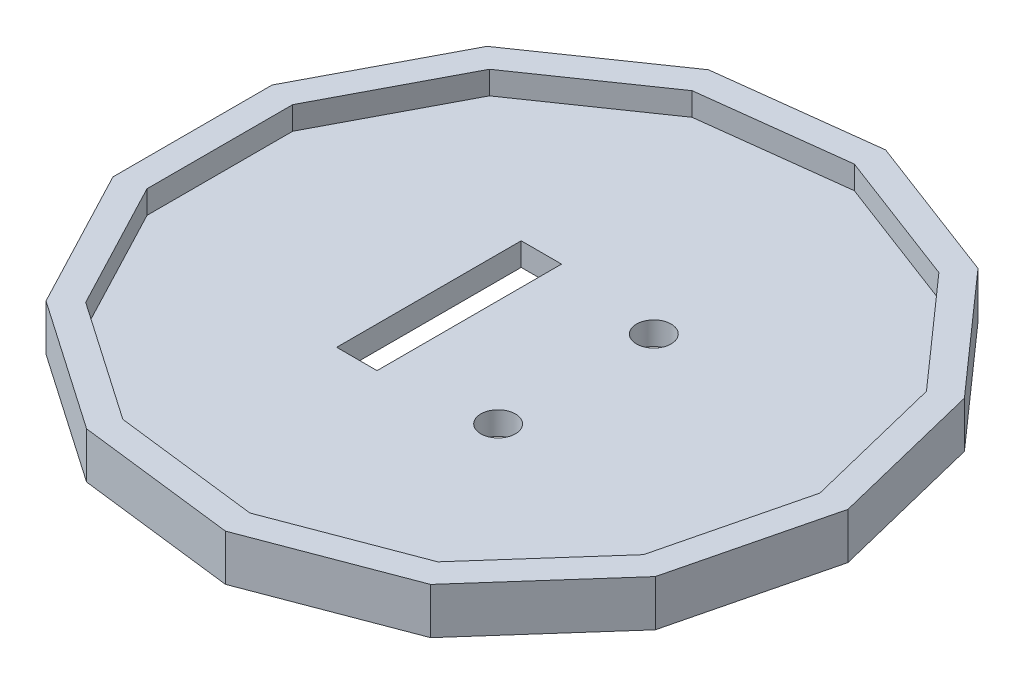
SolidWorks part; units mm, degrees
ref_plane "Front Plane" through (0, 0, 0) normal (0, 0, 1) x (1, 0, 0)
ref_plane "Top Plane" through (0, 0, 0) normal (0, 1, 0) x (1, 0, 0)
ref_plane "Right Plane" through (0, 0, 0) normal (1, 0, 0) x (0, 0, -1)
sketch "Sketch5" plane through (0, 0, 0) normal (0, 1, 0) x (1, 0, 0)
  line L36 (-21.5855, 19.1231) -> (-28, 6.9014)
  line L37 (27.8081, 0) -> (24.6228, 12.923) construction
  line L46 (24.6228, 12.923) -> (15.7968, 22.8856) construction
  line L50 (15.7968, 22.8856) -> (3.3519, 27.6053) construction
  line L51 (3.3519, 27.6053) -> (-9.8609, 26.001) construction
  line L52 (-9.8609, 26.001) -> (-20.8146, 18.4401) construction
  line L58 (-20.8146, 18.4401) -> (-27, 6.6549) construction
  line L59 (-26, -6.4084) -> (-20.0437, -17.7572) construction
  line L60 (-20.0437, -17.7572) -> (-9.4957, -25.038) construction
  line L61 (-9.4957, -25.038) -> (3.2277, -26.5829) construction
  line L62 (3.2277, -26.5829) -> (15.2117, -22.038) construction
  line L63 (-27, 6.6549) -> (-27, -6.6549) construction
  line L64 (-27, -6.6549) -> (-20.8146, -18.4401) construction
  line L65 (-20.8146, -18.4401) -> (-9.8609, -26.001) construction
  line L66 (-9.8609, -26.001) -> (3.3519, -27.6053) construction
  line L67 (3.3519, -27.6053) -> (15.7968, -22.8856) construction
  line L68 (15.7968, -22.8856) -> (24.6228, -12.923) construction
  line L69 (24.6228, -12.923) -> (27.8081, 0) construction
  line L70 (-28, 6.9014) -> (-28, -6.9014)
  line L71 (-28, -6.9014) -> (-21.5855, -19.1231)
  line L72 (-21.5855, -19.1231) -> (-10.2261, -26.964)
  line L73 (-10.2261, -26.964) -> (3.476, -28.6277)
  line L74 (3.476, -28.6277) -> (16.3818, -23.7332)
  line L75 (16.3818, -23.7332) -> (25.5348, -13.4017)
  line L76 (25.5348, -13.4017) -> (28.838, 0)
  line L77 (28.838, 0) -> (25.5348, 13.4017)
  line L78 (25.5348, 13.4017) -> (16.3818, 23.7332)
  line L79 (16.3818, 23.7332) -> (3.476, 28.6277)
  line L80 (3.476, 28.6277) -> (-10.2261, 26.964)
  line L81 (-10.2261, 26.964) -> (-21.5855, 19.1231)
  line L82 (15.2117, -22.038) -> (23.7109, -12.4444) construction
  line L83 (23.7109, -12.4444) -> (26.7781, 0) construction
  line L84 (26.7781, 0) -> (23.7109, 12.4444) construction
  line L85 (23.7109, 12.4444) -> (15.2117, 22.038) construction
  line L86 (15.2117, 22.038) -> (3.2277, 26.5829) construction
  line L87 (3.2277, 26.5829) -> (-9.4957, 25.038) construction
  line L88 (-9.4957, 25.038) -> (-20.0437, 17.7572) construction
  line L89 (-20.0437, 17.7572) -> (-26, 6.4084) construction
  line L90 (-26, 6.4084) -> (-26, -6.4084) construction
  circle A0 centre (0, 0) radius 27 construction
  dimension "D1" = 1
  dimension "D2" = 28
  dimension "D3" = 1
extrude "Sensor Block" add sketch "Sketch5" along normal blind 4
ref_plane "Plane1" through (0, 4, 0) normal (0, 1, 0) x (1, 0, 0)
sketch "Sketch7" plane through (0, 4, 0) normal (0, 1, 0) x (1, 0, 0)
  line L24 (26.4, 0) -> (23.376, 12.2687)
  line L25 (23.376, 12.2687) -> (14.9969, 21.7268)
  line L26 (14.9969, 21.7268) -> (3.1822, 26.2075)
  line L27 (3.1822, 26.2075) -> (-9.3616, 24.6844)
  line L28 (-9.3616, 24.6844) -> (-19.7607, 17.5064)
  line L29 (-19.7607, 17.5064) -> (-25.6329, 6.3179)
  line L30 (-25.6329, 6.3179) -> (-25.6329, -6.3179)
  line L31 (-25.6329, -6.3179) -> (-19.7607, -17.5064)
  line L32 (-19.7607, -17.5064) -> (-9.3616, -24.6844)
  line L33 (-9.3616, -24.6844) -> (3.1822, -26.2075)
  line L34 (3.1822, -26.2075) -> (14.9969, -21.7268)
  line L35 (14.9969, -21.7268) -> (23.376, -12.2687)
  line L36 (23.376, -12.2687) -> (26.4, 0)
  circle A0 centre (0, 0) radius 25.6329 construction
  dimension "D1" = 26.4
extrude "Sensor Base Cut" cut sketch "Sketch7" against normal blind 2
sketch "Sketch9" plane through (0, 0, 0) normal (0, 1, 0) x (1, 0, 0)
  line L0 (-2.2, 0) -> (2.2, 0) construction
  line L1 (-8, -9.5) -> (8, -9.5) construction
  line L2 (-8, -9.5) -> (-8, 9.5) construction
  line L3 (-8, 9.5) -> (8, 9.5) construction
  line L4 (8, -9.5) -> (8, 9.5) construction
  line L5 (-8, -9.5) -> (8, 9.5) construction
  line L6 (-8, 9.5) -> (8, -9.5) construction
  line L8 (-7.5, -8) -> (-4, -8)
  line L9 (-7.5, -8) -> (-7.5, 8)
  line L10 (-7.5, 8) -> (-4, 8)
  line L11 (-4, -8) -> (-4, 8)
  line L12 (-7.5, -8) -> (-4, 8) construction
  line L13 (-7.5, 8) -> (-4, -8) construction
  circle A0 centre (5.25, 6.75) radius 1.5
  circle A1 centre (5.25, -6.75) radius 1.5
  point P0 (0, 0)
  point P12 (-5.75, 0)
  dimension "D3" = 2.75
  dimension "D5" = 3
  dimension "D1" = 16
  dimension "D2" = 19
  dimension "D4" = 2.75
  dimension "D6" = 16
  dimension "D7" = 4
  dimension "D8" = 3.5
extrude "Sensor Holes" cut sketch "Sketch9" along normal blind 2
